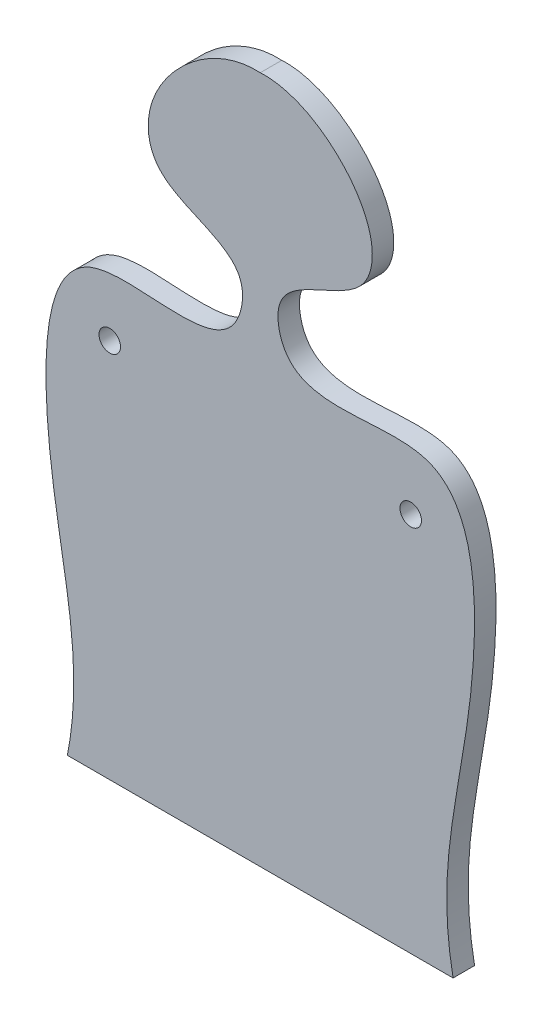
SolidWorks part; units mm, degrees
ref_plane "Front Plane" through (0, 0, 0) normal (0, 0, 1) x (1, 0, 0)
ref_plane "Top Plane" through (0, 0, 0) normal (0, 1, 0) x (1, 0, 0)
ref_plane "Right Plane" through (0, 0, 0) normal (1, 0, 0) x (0, 0, -1)
sketch "Sketch1" plane through (0, 0, 0) normal (0, 0, 1) x (1, 0, 0)
  line L0 (0, 0) -> (0, 101.6) construction
  line L1 (28.4959, 0) -> (-28.4959, 0)
  circle A0 centre (-22.2358, 56.1946) radius 1.5875
  circle A1 centre (22.2358, 56.1946) radius 1.5875
  spline S0 degree 3 poles (0, 101.6) (-6.8638, 102.0164) (-17.5721, 92.8672) (-16.0609, 78.4871) (-1.2103, 77.7137) (-4.3834, 60.6033) (-30.8951, 71.6036) (-33.154, 31.6367) (-25.5122, 15.3131) (-28.4959, 0) knots 0 0 0 0 0.126396 0.183966 0.298788 0.340191 0.504457 0.67519 1 1 1 1
  spline S2 degree 3 poles (0, 101.6) (6.8638, 102.0164) (17.5721, 92.8672) (16.0609, 78.4871) (1.2103, 77.7137) (4.3834, 60.6033) (30.8951, 71.6036) (33.154, 31.6367) (25.5122, 15.3131) (28.4959, 0) knots 0 0 0 0 0.126396 0.183966 0.298788 0.340191 0.504457 0.67519 1 1 1 1
  dimension "D2" = 3.175
  dimension "D1" = 101.6
extrude "Boss-Extrude1" add sketch "Sketch1" along normal blind 3.175
